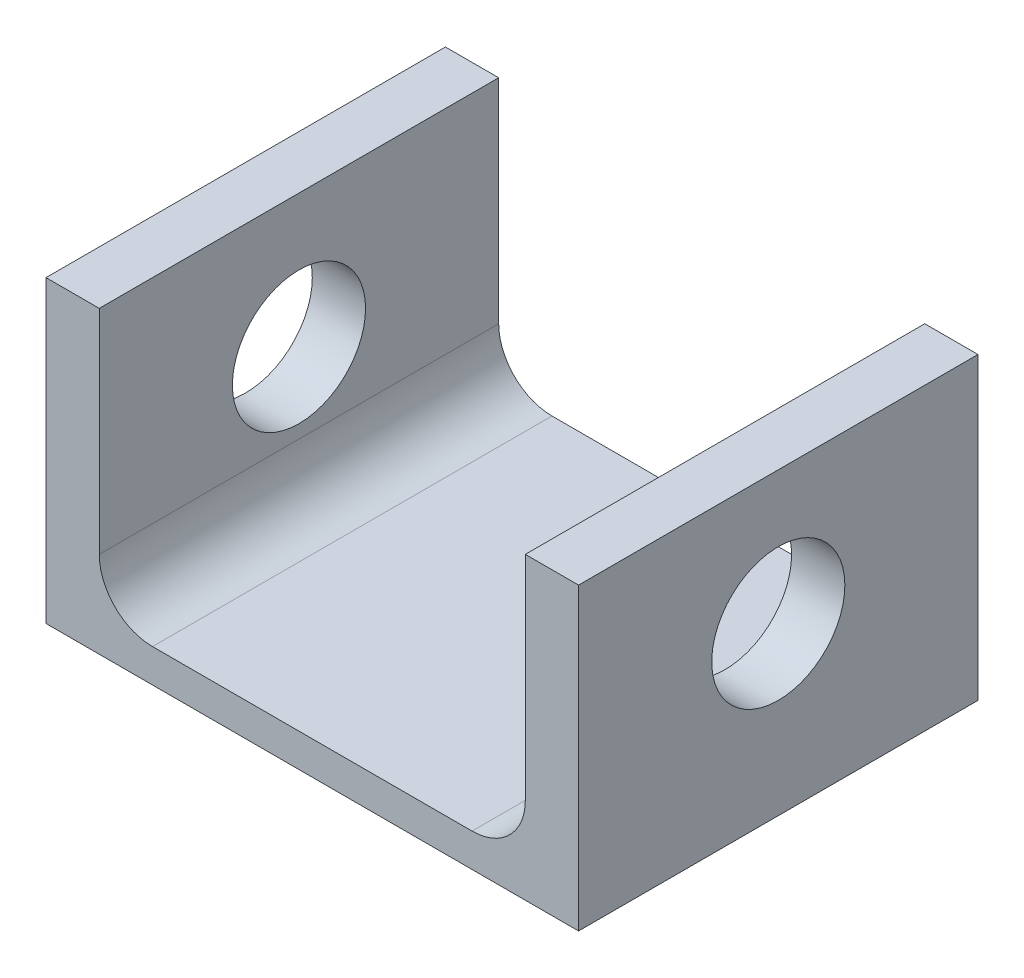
SolidWorks part; units mm, degrees
ref_plane "Plan de face" through (0, 0, 0) normal (0, 0, 1) x (1, 0, 0)
ref_plane "Plan de dessus" through (0, 0, 0) normal (0, 1, 0) x (1, 0, 0)
ref_plane "Plan de droite" through (0, 0, 0) normal (1, 0, 0) x (0, 0, -1)
imported_body "Importée1"
sketch "Esquisse1" plane through (40, 0, 0) normal (1, 0, 0) x (0, 0, -1)
  line L0 (-30, 0) -> (-30, 45) construction
  line L1 (-30, 0) -> (30, 0) construction
  circle A0 centre (0, 25) radius 10
  dimension "D1" = 20
  dimension "D2" = 30
  dimension "D3" = 25
extrude "Extrusion1" cut sketch "Esquisse1" against normal through all
